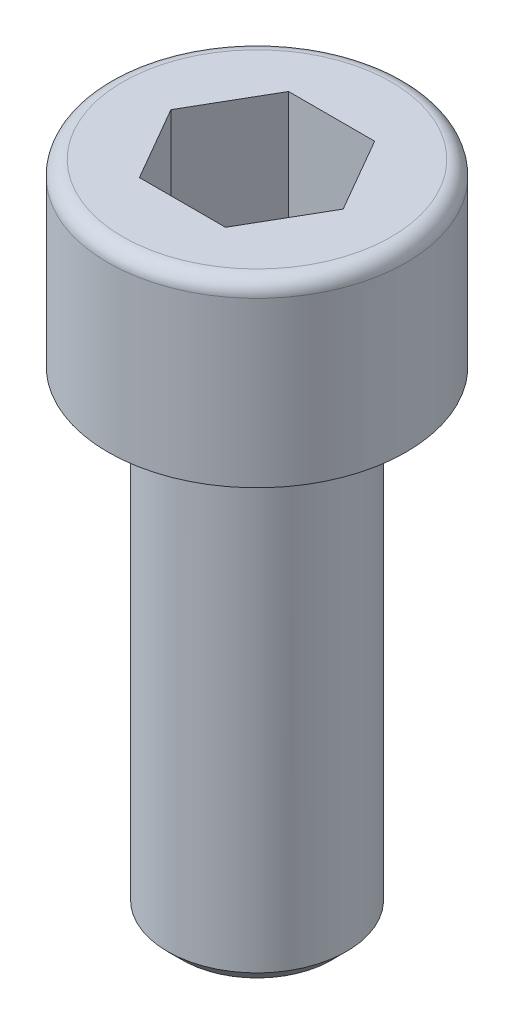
SolidWorks part; units mm, degrees
ref_plane "Plan1" through (0, 0, 0) normal (0, 0, 1) x (1, 0, 0)
ref_plane "Plan2" through (0, 0, 0) normal (0, 1, 0) x (1, 0, 0)
ref_plane "Plan3" through (0, 0, 0) normal (1, 0, 0) x (0, 0, -1)
sketch "Esquisse1" plane through (0, 0, 0) normal (0, 0, 1) x (1, 0, 0)
  line L0 (0, 50) -> (0, -40) construction
  line L1 (0, 22) -> (-4.5, 22)
  line L3 (-5, 21.5) -> (-5, 16)
  line L4 (-5, 16) -> (-3, 16)
  line L7 (-3, 16) -> (-3, 0)
  line L12 (-3, 0) -> (0, 0)
  line L13 (0, 22) -> (0, 0)
  arc A0 (-5, 21.5) -> (-4.5, 22) centre (-4.5, 21.5) cw
  dimension "D1" = 0.5
  dimension "D2" = 5
  dimension "D3" = 16
  dimension "D4" = 6
  dimension "D7" = 3
revolve "Base-Révolution" add sketch "Esquisse1" angle 360 about L0
sketch "Esquisse2" plane through (0, 22, 0) normal (0, 1, 0) x (-1, 0, 0)
  line L0 (-2.8868, 0) -> (2.8868, 0) construction
  line L1 (-1.4434, -2.5) -> (1.4434, 2.5) construction
  line L2 (1.4434, -2.5) -> (-1.4434, 2.5) construction
  line L3 (1.4434, -2.5) -> (-1.4434, -2.5)
  line L4 (-1.4434, -2.5) -> (-2.8868, 0)
  line L5 (-2.8868, 0) -> (-1.4434, 2.5)
  line L6 (-1.4434, 2.5) -> (1.4434, 2.5)
  line L7 (1.4434, 2.5) -> (2.8868, 0)
  line L8 (2.8868, 0) -> (1.4434, -2.5)
  dimension "D1" = 5
extrude "Enlèv. mat.-Extru.1" cut sketch "Esquisse2" against normal blind 5
chamfer "Chanfrein1" distance 0.5 angle 45
